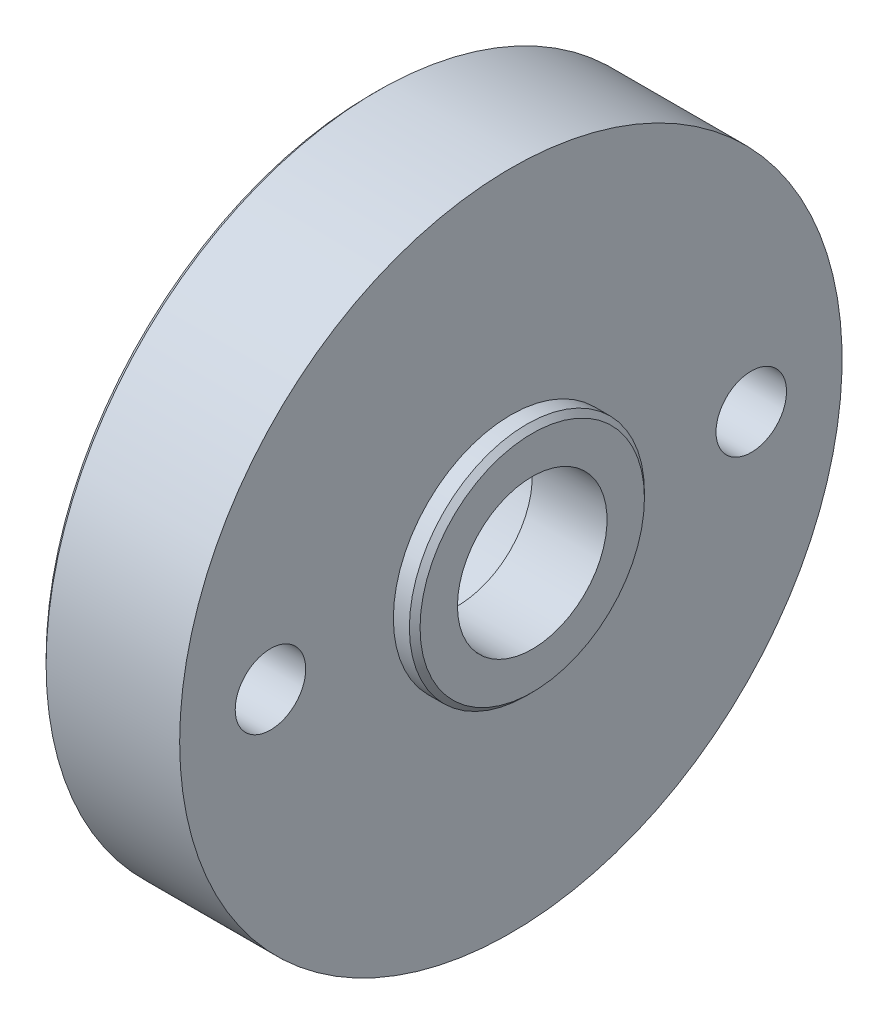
SolidWorks part; units mm, degrees
ref_plane "Plan de face" through (0, 0, 0) normal (0, 0, 1) x (1, 0, 0)
ref_plane "Plan de dessus" through (0, 0, 0) normal (0, 1, 0) x (1, 0, 0)
ref_plane "Plan de droite" through (0, 0, 0) normal (1, 0, 0) x (0, 0, -1)
sketch "Esquisse1" plane through (0, 0, 0) normal (0, 0, 1) x (1, 0, 0)
  line L0 (0, 11) -> (0, 31)
  line L1 (0, 31) -> (13, 31)
  line L2 (13, 31) -> (13, 11)
  line L3 (13, 11) -> (15, 11)
  line L4 (15, 11) -> (15, 7)
  line L5 (15, 7) -> (8, 7)
  line L6 (8, 7) -> (8, 11)
  line L7 (8, 11) -> (0, 11)
  line L8 (0, 0) -> (58.5533, 0) construction
  dimension "D1" = 7
  dimension "D2" = 11
  dimension "D3" = 15
  dimension "D4" = 2
  dimension "D5" = 11
  dimension "D6" = 31
  dimension "D7" = 8
revolve "Révolution1" add sketch "Esquisse1" angle 360 about L8
chamfer "Chanfrein1" distance 0.5 angle 45 3 edges at (0, 0, 11) (0, 0, 31) (15, 0, 11)
hole_wizard "Chambrage pour vis à tête ronde bombée M61" positions "Esquisse3" profile "Esquisse2" counterbore size "M6" standard "Ansi Métrique"
sketch "Esquisse3" plane through (0, 0, 0) normal (-1, 0, 0) x (0, 0, 1)
  point P0 (-22.5, 0)
  dimension "D1" = 22.5
sketch "Esquisse2" plane through (0, 0, -22.5) normal (0, 1, 0) x (0, 0, 1)
  line L0 (0, 0) -> (0, 13.001)
  line L1 (0, 13.001) -> (3.3, 13.001)
  line L3 (3.3, 13.001) -> (3.3, 6.6)
  line L4 (3.3, 6.6) -> (6.5, 6.6)
  line L5 (6.5, 6.6) -> (6.5, 0)
  line L7 (6.5, 0) -> (0, 0)
  line L11 (0, -6.35) -> (0, 107.95) construction
  dimension "Diamètre du perçage jusqu'au prochain" = 6.6
  dimension "Profondeur du perçage jusqu'au prochain" = 13.001
  dimension "Diamètre du chambrage" = 13
  dimension "Profondeur du chambrage" = 6.6
mirror "Symétrie1" about plane through (0, 0, 0) normal (0, 0, 1) of "Chambrage pour vis à tête ronde bombée M61"
